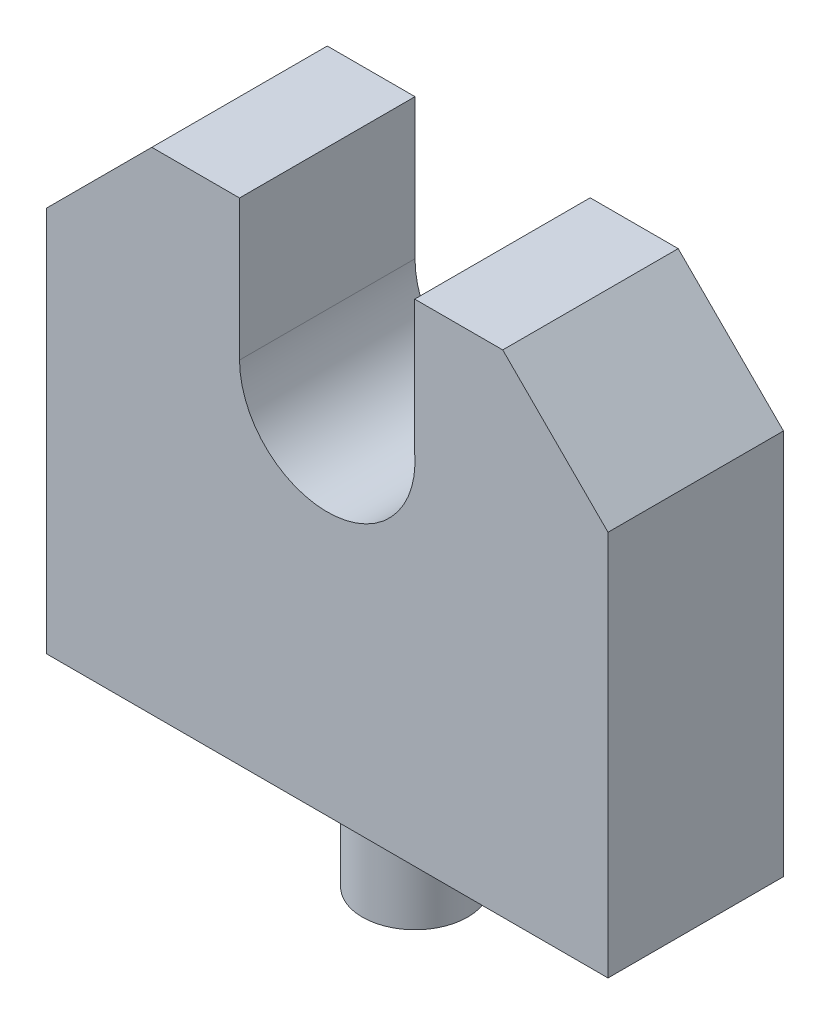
SolidWorks part; units mm, degrees
ref_plane "正面" through (0, 0, 0) normal (0, 0, 1) x (1, 0, 0)
ref_plane "平面" through (0, 0, 0) normal (0, 1, 0) x (1, 0, 0)
ref_plane "右側面" through (0, 0, 0) normal (1, 0, 0) x (0, 0, -1)
sketch "ｽｹｯﾁ1" plane through (0, 0, 0) normal (0, 0, 1) x (1, 0, 0)
  line L1 (0, 0) -> (160, 0)
  line L2 (0, 0) -> (0, 140)
  line L3 (0, 140) -> (160, 140)
  line L4 (160, 0) -> (160, 140)
  dimension "D1" = 160
  dimension "D2" = 140
extrude "押し出し1" add sketch "ｽｹｯﾁ1" along normal blind 50
sketch "ｽｹｯﾁ2" plane through (0, 0, 50) normal (0, 0, 1) x (1, 0, 0)
  line L0 (0, 0) -> (160, 0) construction
  line L2 (0, 140) -> (0, 0) construction
  circle A0 centre (80, 100) radius 25
  dimension "D1" = 50
  dimension "D2" = 100
  dimension "D3" = 80
extrude "押し出し2" cut sketch "ｽｹｯﾁ2" against normal through all
sketch "ｽｹｯﾁ3" plane through (0, 0, 50) normal (0, 0, 1) x (1, 0, 0)
  line L0 (160, 140) -> (0, 140) construction
  line L1 (55, 100) -> (104.9166, 100)
  line L2 (55, 100) -> (55, 140)
  line L3 (55, 140) -> (104.9166, 140)
  line L4 (104.9166, 100) -> (104.9166, 140)
  circle A0 centre (80, 100) radius 25 construction
extrude "押し出し3" cut sketch "ｽｹｯﾁ3" against normal through all
sketch "ｽｹｯﾁ4" plane through (0, 0, 0) normal (0, -1, 0) x (1, 0, 0)
  line L0 (160, 50) -> (160, 0) construction
  line L4 (0, 0) -> (160, 0) construction
  circle A0 centre (80, 25) radius 15
  dimension "D1" = 30
  dimension "D2" = 80
  dimension "D3" = 25
extrude "押し出し4" add sketch "ｽｹｯﾁ4" along normal blind 30
chamfer "面取り1" distance 30 angle 45 2 edges at (0, 140, 25) (160, 140, 25)
